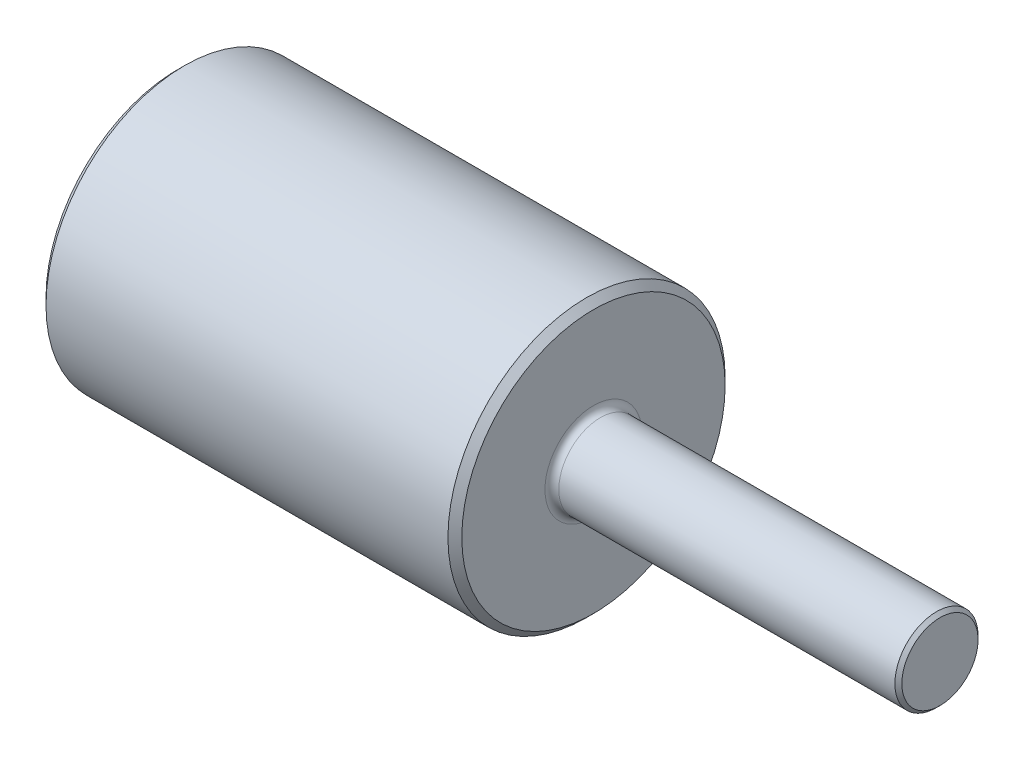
SolidWorks part; units mm, degrees
ref_plane "Face" through (0, 0, 0) normal (0, 0, 1) x (1, 0, 0)
ref_plane "Dessus" through (0, 0, 0) normal (0, 1, 0) x (1, 0, 0)
ref_plane "Droite" through (0, 0, 0) normal (1, 0, 0) x (0, 0, -1)
sketch "Esquisse1" plane through (0, 0, 0) normal (0, 0, 1) x (1, 0, 0)
  line L0 (0, 0) -> (0, 3)
  line L1 (0, 3) -> (-25, 3)
  line L2 (-25, 3) -> (-25, 10)
  line L3 (-25, 10) -> (-55, 10)
  line L4 (-55, 10) -> (-55, 0)
  line L5 (-55, 0) -> (0, 0)
  line L6 (-58.6699, 0) -> (11.4034, 0) construction
  dimension "D1" = 3
  dimension "D2" = 25
  dimension "D3" = 10
  dimension "D4" = 30
revolve "Base-Révolution" add sketch "Esquisse1" angle 360 about L6
chamfer "Chanfrein1" distance 0.25 angle 45 1 edges at (0, 0, 3)
chamfer "Chanfrein3" distance 0.5 angle 45 2 edges at (-55, 0, 10) (-25, 0, 10)
fillet "Congé1" radius 0.5 1 edges at (-25, 0, 3)
